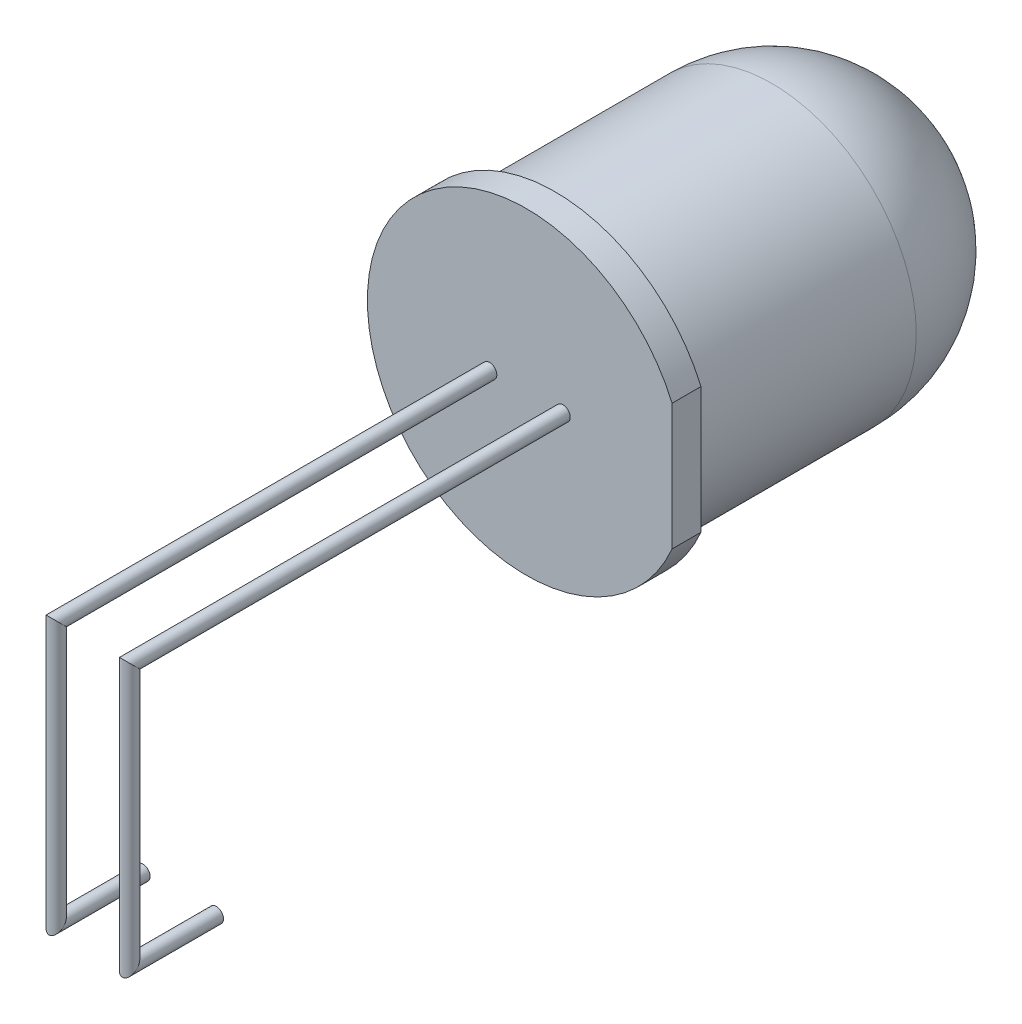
SolidWorks part; units mm, degrees
ref_plane "Face" through (0, 0, 0) normal (0, 0, 1) x (1, 0, 0)
ref_plane "Dessus" through (0, 0, 0) normal (0, 1, 0) x (1, 0, 0)
ref_plane "Droite" through (0, 0, 0) normal (1, 0, 0) x (0, 0, -1)
sketch "Esquisse1" plane through (0, 0, 0) normal (0, 0, 1) x (1, 0, 0)
  circle A0 centre (0, 0) radius 5
extrude "Base-Extrusion" add sketch "Esquisse1" along normal blind 13.5
sketch "Esquisse2" plane through (0, 0, 13.5) normal (0, 0, 1) x (1, 0, 0)
  line L0 (5.0476, -2.4917) -> (5.0476, 2.5621) construction
  line L1 (5.0476, 2.1843) -> (5.0476, -2.1843)
  arc A0 (5.0476, 2.1843) -> (5.0476, -2.1843) centre (0, 0) ccw
extrude "Boss.-Extru.1" add sketch "Esquisse2" against normal blind 1
fillet "Congé1" radius 5 1 edges at (5, 0, 0)
sketch "Esquisse3" plane through (0, 0, 13.5) normal (0, 0, 1) x (1, 0, 0)
  line L0 (6.6041, 0) -> (-9.0558, 0) construction
  line L1 (0, -6.5869) -> (0, 7.9113) construction
  line L2 (-1.27, 2.2189) -> (-1.27, -1.5916) construction
  circle A0 centre (-1.27, 0) radius 0.25
  dimension "D1" = 1.27
ref_plane "Plan1" through (-1.27, 0, 0) normal (1, 0, 0) x (0, 0, -1)
sketch "Esquisse4" plane through (-1.27, 0, 0) normal (1, 0, 0) x (0, 0, -1)
  line L0 (-13.5, 0) -> (-33.943, 0) construction
  line L1 (-28.5, -9.04) -> (-25.5, -9.04)
  line L2 (-13.5, 6.7858) -> (-13.5, -8.0266) construction
  line L3 (-28.5, 5.6624) -> (-28.5, -6.9656) construction
  line L4 (-13.5, -6.5869) -> (-13.5, 7.9113) construction
  line L5 (-33.943, -9.04) -> (-13.0406, -9.04) construction
  line L6 (-13.5, 0) -> (-28.5, 0)
  line L7 (-28.5, 0) -> (-28.5, -9.04)
  line L8 (-25.5, -15.4361) -> (-25.5, -8.6276) construction
  dimension "D1" = 15
  dimension "D2" = 9.04
  dimension "D3" = 3
sweep "Balayage1" add profiles "Esquisse3" path "Esquisse4"
ref_plane "Plan2" through (0, 0, 0) normal (1, 0, 0) x (0, 0, -1)
mirror "Symétrie1" about plane through (0, 0, 0) normal (1, 0, 0) of "Balayage1"
